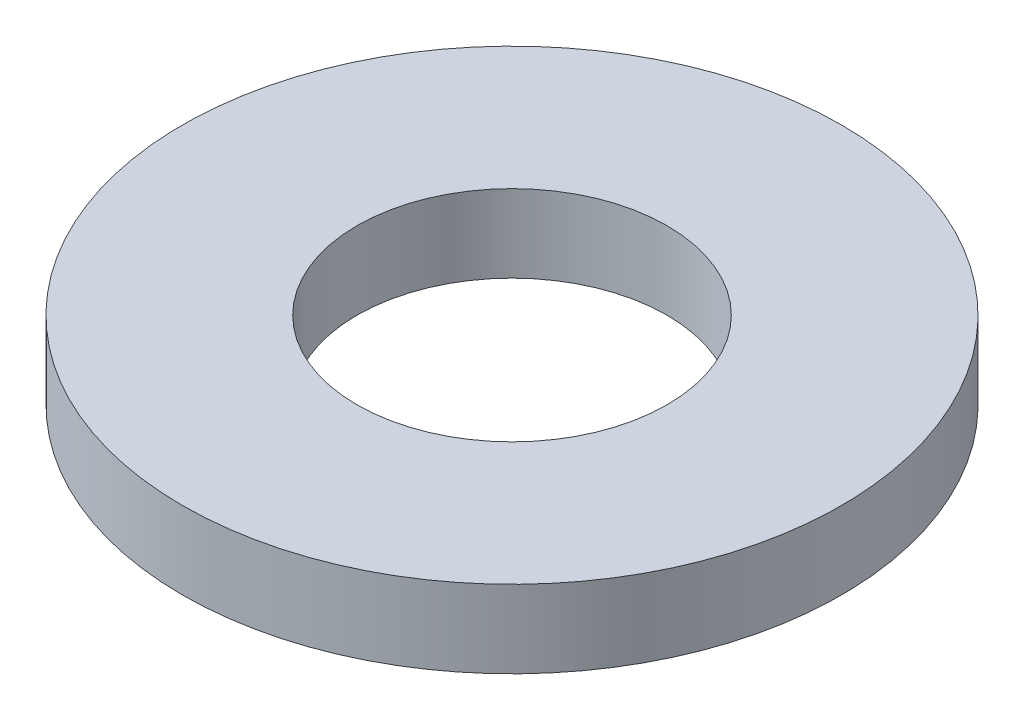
SolidWorks part; units mm, degrees
ref_plane "前视基准面" through (0, 0, 0) normal (0, 0, 1) x (1, 0, 0)
ref_plane "上视基准面" through (0, 0, 0) normal (0, 1, 0) x (1, 0, 0)
ref_plane "右视基准面" through (0, 0, 0) normal (1, 0, 0) x (0, 0, -1)
sketch "草图1" plane through (0, 0, 0) normal (0, 1, 0) x (1, 0, 0)
  circle A0 centre (0, 0) radius 2
  circle A1 centre (0, 0) radius 4.25
  dimension "D1" = 4
  dimension "D2" = 8.5
extrude "凸台-拉伸1" add sketch "草图1" along normal blind 1
